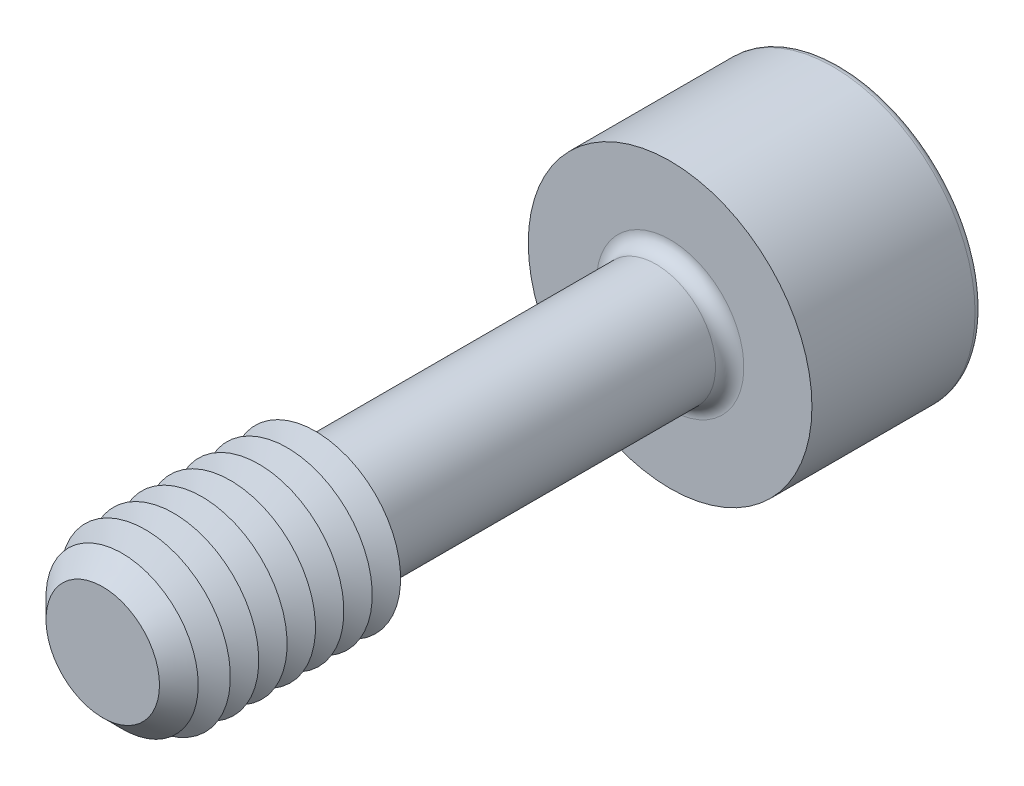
SolidWorks part; units mm, degrees
ref_plane "Front Plane" through (0, 0, 0) normal (0, 0, 1) x (1, 0, 0)
ref_plane "Top Plane" through (0, 0, 0) normal (0, 1, 0) x (1, 0, 0)
ref_plane "Right Plane" through (0, 0, 0) normal (1, 0, 0) x (0, 0, -1)
sketch "Sketch1" plane through (0, 0, 0) normal (0, 0, 1) x (1, 0, 0)
  circle A0 centre (0, 0) radius 2.1
  dimension "D1" = 4.2
extrude "Extrude1" add sketch "Sketch1" along normal mid plane 20
sketch "Sketch2" plane through (0, 0, 0) normal (1, 0, 0) x (0, 0, -1)
  line L0 (-10, 0) -> (-10, 3)
  line L1 (-10, 2.1) -> (-10, -2.1) construction
  line L2 (-10, 3) -> (-2.5, 3)
  line L3 (-2.5, 3) -> (-1.9804, 2.1)
  line L4 (10, 2.1) -> (-10, 2.1) construction
  line L5 (-1.9804, 2.1) -> (-1.9804, 0)
  line L6 (-1.9804, 0) -> (-10, 0)
  dimension "D1" = 3
  dimension "D2" = 120
  dimension "D3" = 7.5
revolve "Revolve1" add sketch "Sketch2" angle 360 about L6
chamfer "Chamfer1" distance 1 angle 45 1 edges at (0, 3, 10)
sketch "Sketch3" plane through (0, 0, -10) normal (0, 0, -1) x (-1, 0, 0)
  circle A0 centre (0, 0) radius 5
  dimension "D1" = 10
extrude "Extrude2" add sketch "Sketch3" along normal blind 6
sketch "Sketch4" plane through (-13.7, 0, -16) normal (0, 0, 1) x (1, 0, 0)
  line L2 (12.2566, -2.5) -> (15.1434, -2.5)
  line L3 (15.1434, -2.5) -> (16.5868, 0)
  line L4 (16.5868, 0) -> (15.1434, 2.5)
  line L6 (15.1434, 2.5) -> (12.2566, 2.5)
  line L7 (12.2566, 2.5) -> (10.8132, 0)
  line L8 (10.8132, 0) -> (12.2566, -2.5)
  circle A0 centre (13.7, 0) radius 2.5 construction
  dimension "D1" = 5
extrude "Extrude3" cut sketch "Sketch4" along normal blind 5
fillet "Fillet1" radius 0.5 1 edges at (-2.1, 0, -10)
fillet "Fillet2" radius 0.25 1 edges at (-5, 0, -16)
sketch "Sketch5" plane through (0, 0, 0) normal (1, 0, 0) x (0, 0, -1)
  line L0 (11, 0) -> (11, -2.5)
  line L1 (11, -2.5) -> (9.5566, 0)
  line L2 (9.5566, 0) -> (11, 0)
  dimension "D1" = 30
revolve "Cut-Revolve1" cut sketch "Sketch5" angle 360 about L2
sketch "Sketch6" plane through (0, 0, 0) normal (1, 0, 0) x (0, 0, -1)
  line L0 (1.332, 0) -> (-13.289, 0) construction
sketch "Sketch7" plane through (0, 0, 0) normal (1, 0, 0) x (0, 0, -1)
  line L0 (-2.5, 3) -> (-3, 2.134)
  line L1 (-3, 2.134) -> (-3.5, 3)
  line L2 (-2.5, 3) -> (-9, 3) construction
  line L3 (-3.5, 3) -> (-2.5, 3)
  dimension "D1" = 1
revolve "Cut-Revolve2" cut sketch "Sketch7" angle 360 about L0
pattern_linear "LPattern1" count 7 spacing 1 along (0, 0, 1) of "Cut-Revolve2"
